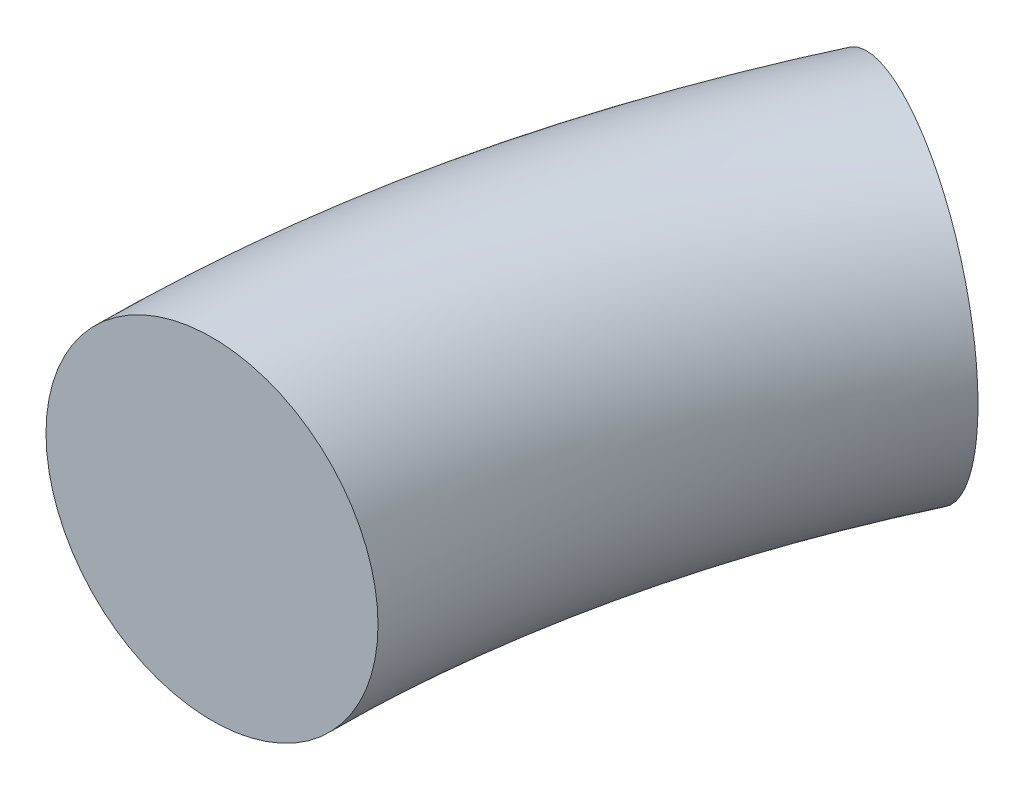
SolidWorks part; units mm, degrees
ref_plane "Front Plane" through (0, 0, 0) normal (0, 0, 1) x (1, 0, 0)
ref_plane "Top Plane" through (0, 0, 0) normal (0, 1, 0) x (1, 0, 0)
ref_plane "Right Plane" through (0, 0, 0) normal (1, 0, 0) x (0, 0, -1)
sketch "Sketch1" plane through (0, 0, 0) normal (0, 0, 1) x (1, 0, 0)
  line L0 (-30.1011, 41.5682) -> (-30.1011, -22.8039) construction
  circle A0 centre (-34.8636, 9.3822) radius 0.5953
  dimension "D1" = 1.1906
  dimension "D2" = 4.7625
revolve "Revolve1" add sketch "Sketch1" angle 25 about L0
